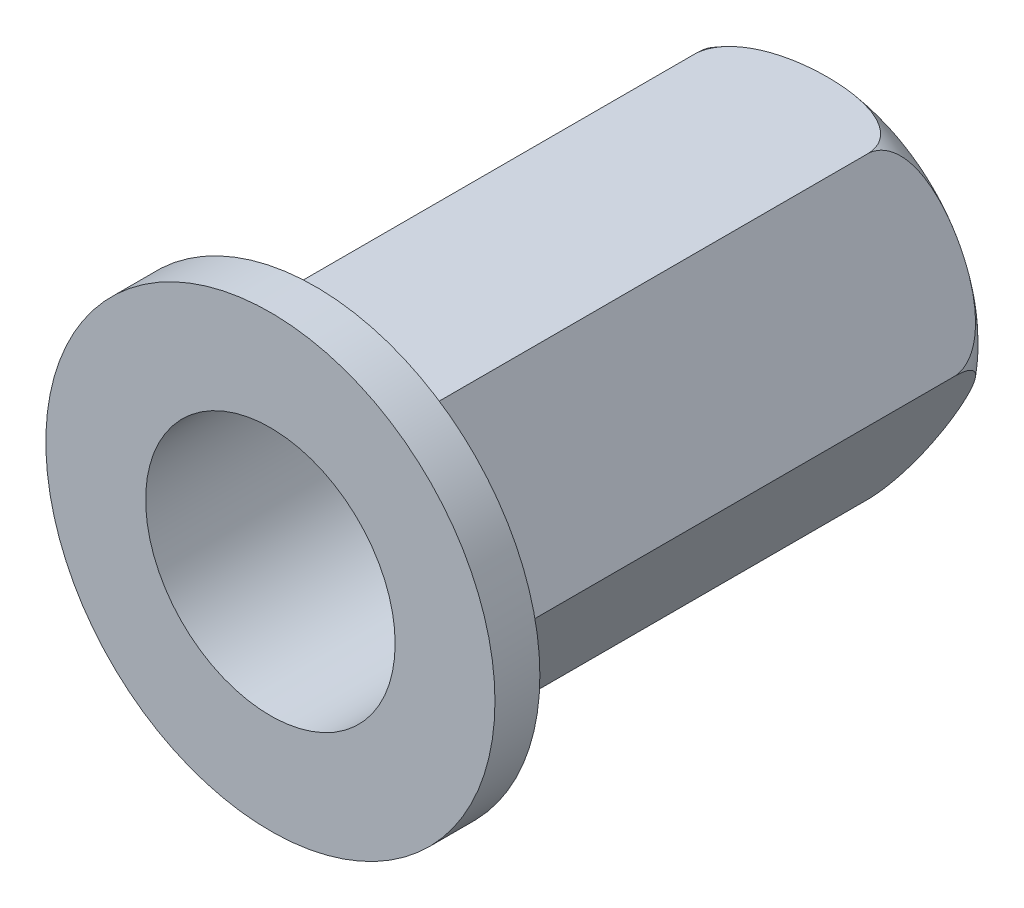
SolidWorks part; units mm, degrees
ref_plane "Front" through (0, 0, 0) normal (0, 0, 1) x (1, 0, 0)
ref_plane "Top" through (0, 0, 0) normal (0, 1, 0) x (1, 0, 0)
ref_plane "Right" through (0, 0, 0) normal (1, 0, 0) x (0, 0, -1)
sketch "Sketch3" plane through (0, 0, 0) normal (0, 0, 1) x (1, 0, 0)
  circle A0 centre (0, 0) radius 9
  dimension "dk" = 18
extrude "BaseHead" add sketch "Sketch3" against normal blind 1.8
sketch "Sketch4" plane through (2.8191, -1.6346, -1.8) normal (0, 0, -1) x (-1, 0, 0)
  line L1 (-0.645, 7.6346) -> (-4.1091, 1.6346)
  line L2 (-4.1091, 1.6346) -> (-0.645, -4.3654)
  line L3 (-0.645, -4.3654) -> (6.2832, -4.3654)
  line L4 (6.2832, -4.3654) -> (9.7473, 1.6346)
  line L5 (9.7473, 1.6346) -> (6.2832, 7.6346)
  line L6 (6.2832, 7.6346) -> (-0.645, 7.6346)
  circle A0 centre (2.8191, 1.6346) radius 6 construction
  circle A1 centre (2.8191, 1.6346) radius 6 construction
  circle A2 centre (2.8191, 1.6346) radius 9 construction
  dimension "s" = 12
extrude "BaseBody" add sketch "Sketch4" along normal blind 21
sketch "Sketch5" plane through (4.0795, 0.9752, 0) normal (0, 0, 1) x (1, 0, 0)
  circle A0 centre (-4.0795, -0.9752) radius 5
  circle A1 centre (-4.0795, -0.9752) radius 9 construction
  dimension "d1" = 10
extrude "Hole1" cut sketch "Sketch5" against normal blind 7.3
sketch "Sketch6" plane through (1.8124, 4.1988, -7.3) normal (0, 0, 1) x (1, 0, 0)
  circle A0 centre (-1.8124, -4.1988) radius 3.5
  circle A1 centre (-1.8124, -4.1988) radius 5 construction
  dimension "D1" = 7
extrude "Hole2" cut sketch "Sketch6" against normal through all
sketch "Sketch7" plane through (8.6603, 0, 20.3033) normal (0, 1, 0) x (-1, 0, 0)
  line L0 (8.6603, 2.4967) -> (8.6603, -3.5015) construction
  line L3 (15.5885, -43.1033) -> (12.1244, -43.1033) construction
  line L5 (15.5885, -43.1033) -> (15.5885, -22.1033) construction
  line L6 (15.5885, -43.1033) -> (13.2551, -43.1033)
  line L8 (15.5885, -43.1033) -> (15.5885, -40.77)
  arc A0 (13.2551, -43.1033) -> (15.5885, -40.77) centre (13.2551, -40.77) ccw
  dimension "r" = 2.3333
revolve "Cut-Revolve1" cut sketch "Sketch7" angle 360 about L0
fillet "Fillet1" radius 0.9 6 edges at (0, -6, -1.8) (-5.1962, -3, -1.8) (-5.1962, 3, -1.8) (0, 6, -1.8) (5.1962, 3, -1.8) (5.1962, -3, -1.8)
chamfer "Chamfer1" distance 0.4667 angle 45 1 edges at (3.5, 0, -22.8)
chamfer "Chamfer2" distance 1.5 angle 45 1 edges at (3.5, 0, -7.3)
sketch "Sketch9" plane through (0, 0, 0) normal (1, 0, 0) x (0, 0, -1)
  line L0 (-5.9053, 0) -> (27.963, 0) construction
  line L1 (22.0833, -3.5) -> (22.0833, -3)
  line L2 (22.0833, -3) -> (22.5833, -3)
  line L3 (22.5833, -3) -> (22.5833, -3.5)
  line L4 (22.5833, -3.5) -> (22.3333, -3.933)
  line L5 (22.3333, -3.933) -> (22.0833, -3.5)
  line L6 (22.3333, -3.5) -> (22.3333, 3.5) construction
  dimension "D1" = 0.5
  dimension "D2" = 7
revolve "Cut-Revolve10" [suppressed] cut sketch "Sketch9" angle 360 about L0
pattern_linear "LPattern10" [suppressed] count 25 spacing 0.6 along (0, 0, -1)
equation "\"D1@Chamfer1\" = \"D1@Sketch6\" / 15"
equation "\"D1@Chamfer2\" =  ( \"d1@Sketch5\" - \"D1@Sketch6\" )  / 2"
equation "\"r@Sketch7\" = \"D1@Chamfer1\" * 5"
equation "\"D1@Sketch9\" = (  \"D2@ThreadCosmetic1\" - \"D1@Sketch6\" )  / 2"
equation "\"D3@LPattern10\" = \"D1@Sketch9\" * 1.2 "
equation "\"D1@LPattern10\" =  (  \"l@BaseBody\" + \"k@BaseHead\" - \"l1@Hole1\" )  / \"D3@LPattern10\" - 1"
equation "\"D1@Fillet1\" = \"dk@Sketch3\" / 20"
equation "\"D2@Sketch9\" = \"D1@Sketch6\""
